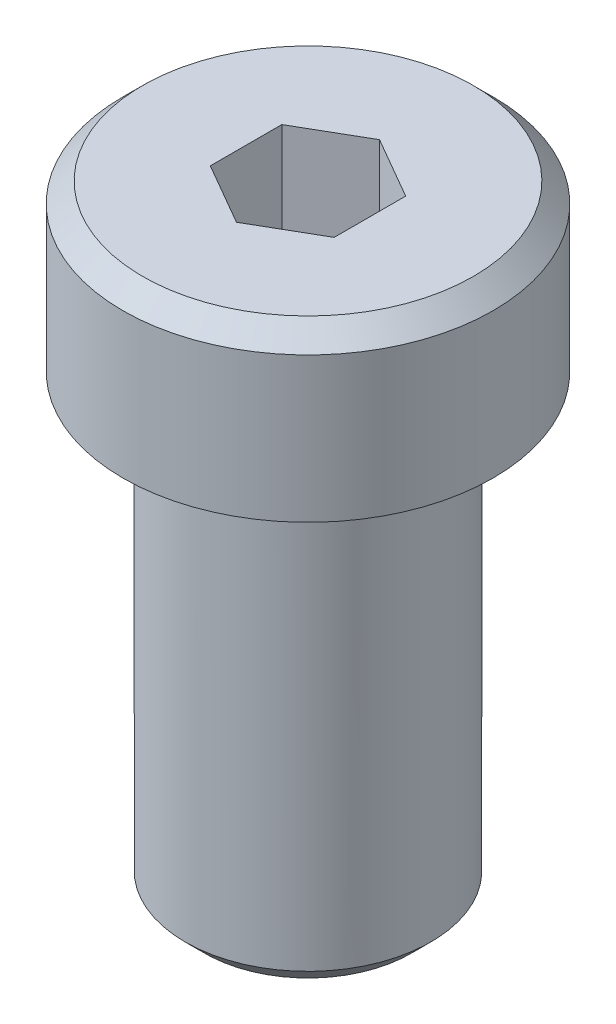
SolidWorks part; units mm, degrees
ref_plane "Plane1" through (0, 0, 0) normal (0, 0, 1) x (1, 0, 0)
ref_plane "Plane2" through (0, 0, 0) normal (0, 1, 0) x (1, 0, 0)
ref_plane "Plane3" through (0, 0, 0) normal (1, 0, 0) x (0, 0, -1)
sketch "Sketch2" plane through (0, 0, 0) normal (0, 0, 1) x (1, 0, 0)
  line L0 (0, 0) -> (7.1374, 0)
  line L1 (7.1374, 0) -> (7.1374, 5.588)
  line L2 (7.1374, 5.588) -> (6.3754, 6.35)
  line L3 (6.3754, 6.35) -> (0, 6.35)
  line L4 (0, 6.35) -> (0, 0)
  line L5 (0, 0) -> (0, 98.4216) construction
  dimension "D1" = 14.2748
  dimension "D2" = 6.35
  dimension "D3" = 45
  dimension "D4" = 0.762
revolve "Base-Revolve" add sketch "Sketch2" angle 360 about L5
sketch "Sketch3" plane through (0, 0, 0) normal (0, 0, 1) x (1, 0, 0)
  line L0 (0, 0) -> (0, 7.8563) construction
  line L1 (0, -17.4498) -> (4.7371, -17.4498)
  line L6 (4.7371, -17.4498) -> (4.7371, 0)
  line L9 (4.7371, 0) -> (0, 0)
  line L10 (0, 0) -> (0, -17.4498)
  line L11 (-7.1374, 0) -> (7.1374, 0) construction
  dimension "D1" = 17.4498
  dimension "D4" = 9.4742
revolve "Boss-Revolve1" add sketch "Sketch3" angle 360 about L0
ref_plane "Plane4" through (0, 6.35, 0) normal (0, 1, 0) x (-1, 0, 0)
sketch "Sketch4" plane through (0, 6.35, 0) normal (0, 1, 0) x (-1, 0, 0)
  line L0 (2.3876, 1.3785) -> (0, 2.757)
  line L1 (0, 2.757) -> (-2.3876, 1.3785)
  line L2 (-2.3876, 1.3785) -> (-2.3876, -1.3785)
  line L3 (-2.3876, -1.3785) -> (0, -2.757)
  line L4 (0, -2.757) -> (2.3876, -1.3785)
  line L5 (2.3876, -1.3785) -> (2.3876, 1.3785)
extrude "Cut-Extrude1" cut sketch "Sketch4" against normal blind 3.5814
chamfer "Chamfer1" distance 0.762 angle 45 1 edges at (0, -17.4498, -4.7371)
